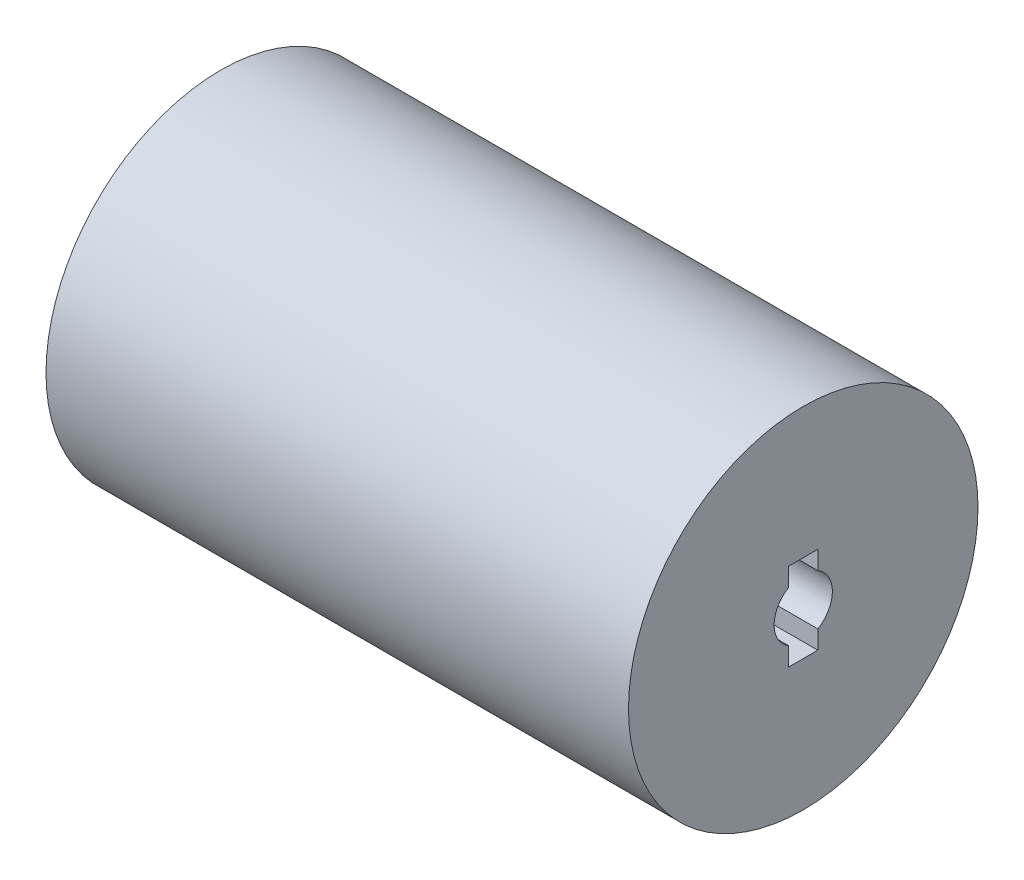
SolidWorks part; units mm, degrees
ref_plane "Front Plane" through (0, 0, 0) normal (0, 0, 1) x (1, 0, 0)
ref_plane "Top Plane" through (0, 0, 0) normal (0, 1, 0) x (1, 0, 0)
ref_plane "Right Plane" through (0, 0, 0) normal (1, 0, 0) x (0, 0, -1)
sketch "Sketch2" plane through (0, 0, 0) normal (1, 0, 0) x (0, 0, -1)
  circle A0 centre (0, 0) radius 30
  dimension "D1" = 60
extrude "Boss-Extrude1" add sketch "Sketch2" along normal blind 100
sketch "Sketch3" plane through (0, 0, 0) normal (1, 0, 0) x (0, 0, -1)
  circle A0 centre (0, 0) radius 5
  dimension "D1" = 10
extrude "Cut-Extrude4" cut sketch "Sketch3" against normal through all both and the other way through all contours A0
sketch "Sketch4" plane through (0, 0, 0) normal (-1, 0, 0) x (0, 0, 1)
  line L1 (-2.5, -7.5) -> (2.5, -7.5)
  line L2 (-2.5, -7.5) -> (-2.5, 7.5)
  line L3 (-2.5, 7.5) -> (2.5, 7.5)
  line L4 (2.5, -7.5) -> (2.5, 7.5)
  line L5 (-2.5, -7.5) -> (2.5, 7.5) construction
  line L6 (-2.5, 7.5) -> (2.5, -7.5) construction
  point P0 (0, 0)
  dimension "D1" = 15
  dimension "D2" = 5
extrude "Cut-Extrude5" cut sketch "Sketch4" against normal through all both and the other way through all
